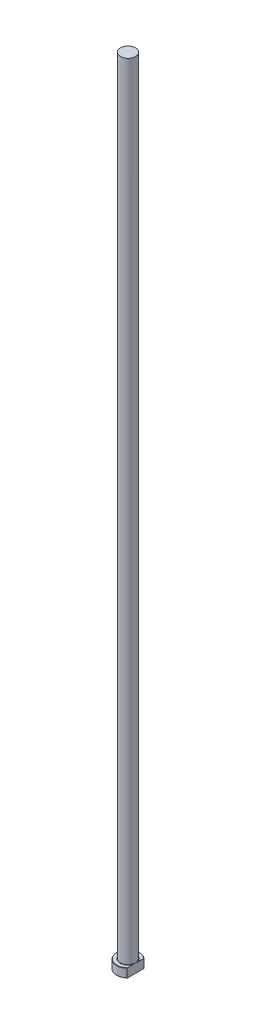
SolidWorks part; units mm, degrees
ref_plane "Front Plane" through (0, 0, 0) normal (0, 0, 1) x (1, 0, 0)
ref_plane "Top Plane" through (0, 0, 0) normal (0, 1, 0) x (1, 0, 0)
ref_plane "Right Plane" through (0, 0, 0) normal (1, 0, 0) x (0, 0, -1)
sketch "Sketch1" plane through (0, 0, 0) normal (0, 0, 1) x (1, 0, 0)
  line L0 (0, 259.9588) -> (0, -15.1925) construction
  line L1 (0, 0) -> (-9, 0)
  line L2 (-9, 0) -> (-9, 7)
  line L3 (-9, 7) -> (-6, 7)
  line L4 (-6, 7) -> (-6, 630)
  line L5 (-6, 630) -> (0, 630)
  line L6 (0, 630) -> (0, 0)
  dimension "L" = 630
  dimension "H" = 18
  dimension "T" = 7
  dimension "D" = 12
revolve "Revolve1" add sketch "Sketch1" angle 360 about L0
chamfer "Chamfer1" distance 0.2 angle 45 2 edges at (0, 7, 9) (0, 0, 9)
fillet "Fillet1" radius 0.3 1 edges at (0, 7, 6)
sketch "Sketch2" plane through (0, 0, 0) normal (0, 1, 0) x (1, 0, 0)
  line L0 (6, 6.7082) -> (6, -6.7082)
  circle A0 centre (0, 0) radius 9 construction
  arc A1 (6, -6.7082) -> (6, 6.7082) centre (0, 0) ccw
  circle A2 centre (0, 0) radius 6 construction
extrude "KEY" cut sketch "Sketch2" along normal through all
